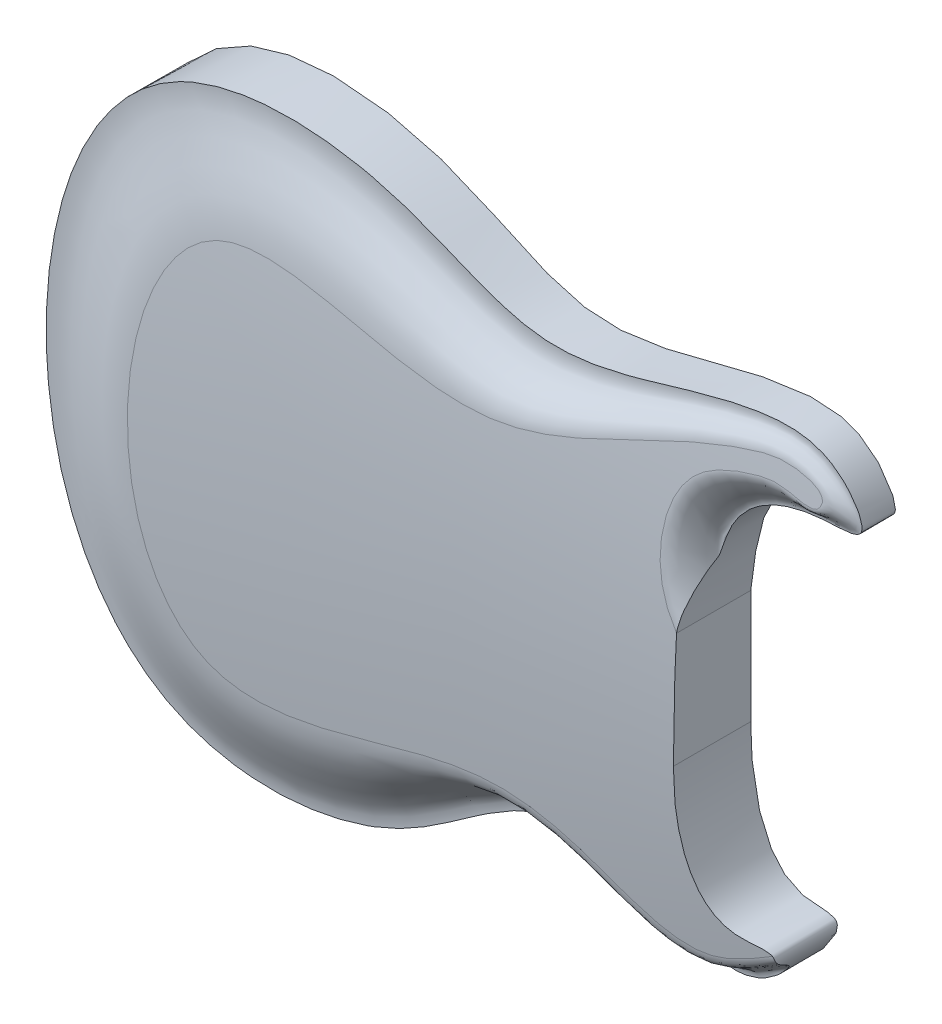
SolidWorks part; units mm, degrees
ref_plane "Front Plane" through (0, 0, 0) normal (0, 0, 1) x (1, 0, 0)
ref_plane "Top Plane" through (0, 0, 0) normal (0, 1, 0) x (1, 0, 0)
ref_plane "Right Plane" through (0, 0, 0) normal (1, 0, 0) x (0, 0, -1)
sketch "Sketch1" plane through (0, 0, 0) normal (0, 1, 0) x (1, 0, 0)
  line L0 (-380.9748, -51.9303) -> (97.4564, -30.6197) construction
  line L2 (-195.3346, 0) -> (195.3346, 0) construction
  line L3 (-592.5941, 1082.777) -> (269.486, 1121.1762) construction
  arc A0 (-380.9748, -51.9303) -> (97.4564, -30.6197) centre (-241.9267, 2207.5326) ccw
  point P2 (72.0815, -31.75)
  point P5 (-355.6, -50.8)
  dimension "D1" = 25.4
  dimension "D2" = 25.4
  dimension "D3" = 30.6197
  dimension "D4" = 97.4564
  dimension "D5" = 2.55
  dimension "D6" = 478.4312
  dimension "D7" = 12.7
  dimension "D8" = 1143
surface "Surface-Revolve1" sketch "Sketch1" parameters "D1"=30
ref_plane "Angled Plane" through (1.5542, 0, 34.8915) normal (0.0445, 0, 0.999) x (0.999, 0, -0.0445)
ref_plane "Plane1" through (0.989, 0, 22.204) normal (0.0445, 0, 0.999) x (0.999, 0, -0.0445)
sketch "Sketch2" plane through (-96.4883, 26.5703, 0) normal (0, 0, 1) x (1, 0, 0)
  line L1 (95.7101, 5.1797) -> (-196.7425, 5.1797) construction
  line L2 (-153.235, 105.762) -> (-153.235, -95.4025) construction
  line L3 (-65.0331, -89.9675) -> (-65.0331, 100.327) construction
  line L4 (-196.7425, 5.1797) -> (-260.2425, 5.1797) construction
  spline S0 degree 3 poles (207.7093, -26.5703) (148.9299, -5.4191) (71.935, 22.2868) (91.5633, 113.7917) (123.9586, 123.4584) (142.7496, 125.8642) (158.7707, 116.9684) (163.7795, 128.6124) (145.0344, 136.8672) (122.7071, 134.0197) (72.0163, 118.2186) (10.7256, 85.4574) (-70.8597, 100.4467) (-171.2577, 127.8192) (-210.7031, 4.9736) (-171.2932, -116.7149) (-66.5757, -90.9043) (-1.1762, -72.3825) (57.9574, -91.1798) (97.6769, -120.898) (155.3598, -95.4036) (183.8897, -70.5749) (207.7093, -49.8455) knots 0 0 0 0 0.128417 0.168213 0.191991 0.205462 0.220099 0.221295 0.235526 0.252941 0.284296 0.364515 0.419541 0.493426 0.585025 0.676623 0.750509 0.814713 0.847251 0.905045 0.920723 1 1 1 1
  dimension "D2" = 63.5
surface "Top Shape Trim"
sketch "Sketch3" plane through (0.989, 0, 22.204) normal (0.0445, 0, 0.999) x (0.999, 0, -0.0445)
  line L2 (29.1269, -97.8003) -> (104.2908, -52.1742) construction
  spline S1 degree 3 number of poles 252 (29.1269, -97.8003) -> (76.5867, 152.7438) construction
  spline S2 degree 3 number of poles 304 (110.6938, 8.1763) -> (104.2908, -52.1742)
  spline S3 degree 3 poles (76.5867, 152.7438) (77.0116, 152.023) (77.4158, 151.288) (78.1933, 149.7377) (78.5639, 148.9193) (79.2069, 147.255) (79.4824, 146.4068) (79.7761, 145.0925) (79.8529, 144.6501) (79.923, 143.9829) (79.9388, 143.7596) (79.9519, 143.3111) (79.9492, 143.0852) (79.9071, 142.4148) (79.8353, 141.9747) (79.5574, 141.1152) (79.3552, 140.7152) (78.8011, 139.9986) (78.4665, 139.6994) (77.7203, 139.1896) (77.3227, 138.9873) (76.4981, 138.6462) (76.0681, 138.5075) (75.2059, 138.2775) (74.7724, 138.1854) (73.467, 137.9542) (72.5904, 137.8587) (70.8312, 137.7244) (69.9485, 137.6867) (67.2957, 137.6172) (65.5204, 137.6282) (61.9713, 137.6325) (60.198, 137.626) (54.9028, 137.4324) (51.4013, 137.1025) (44.4679, 135.955) (41.0357, 135.1388) (36.8018, 133.7239) (35.9578, 133.4209) (34.2761, 132.7717) (33.4415, 132.4266) (30.978, 131.3356) (29.3812, 130.5312) (26.2852, 128.7568) (24.7861, 127.7868) (22.6175, 126.196) (21.908, 125.6431) (20.5172, 124.4895) (19.839, 123.8913) (17.8754, 122.0484) (16.6527, 120.7495) (14.3794, 118.0118) (13.3299, 116.572) (11.8745, 114.3155) (11.4091, 113.5472) (10.5158, 111.9803) (10.0891, 111.1837) (8.8743, 108.7783) (8.1462, 107.1459) (6.6995, 103.5299) (6.0067, 101.5373) (5.3859, 99.5193) knots 0.896592 0.896592 0.896592 0.896592 0.898438 0.898438 0.900391 0.900391 0.902344 0.902344 0.90332 0.90332 0.903809 0.903809 0.904297 0.904297 0.905273 0.905273 0.90625 0.90625 0.907227 0.907227 0.908203 0.908203 0.90918 0.90918 0.910156 0.910156 0.912109 0.912109 0.914063 0.914063 0.917969 0.917969 0.921875 0.921875 0.929688 0.929688 0.9375 0.9375 0.939453 0.939453 0.941406 0.941406 0.945313 0.945313 0.949219 0.949219 0.951172 0.951172 0.953125 0.953125 0.957031 0.957031 0.960938 0.960938 0.962891 0.962891 0.964844 0.964844 0.96875 0.96875 0.973375 0.973375 0.973375 0.973375 construction
  spline S4 degree 3 poles (5.3859, 99.5193) (3.3161, 93.0347) (11.5035, 51.9374) (81.5334, 21.0414) (110.6938, 8.1763) knots 0 0 0 0 0.583601 1 1 1 1 construction
sketch "Sketch4" plane through (0.989, 0, 22.204) normal (0.0445, 0, 0.999) x (0.999, 0, -0.0445)
  line L5 (110.6938, 8.1763) -> (104.2908, -52.1742)
  spline S0 degree 3 number of poles 304 (110.6938, 8.1763) -> (104.2908, -52.1742) construction
  spline S1 degree 3 number of poles 304 (110.6938, 8.1763) -> (104.2908, -52.1742)
surface "Construction Surface for Loft" sketch "Sketch4"
surface "Shape Loft"
delete or keep bodies "Body-Delete1" type delete bodies bodies 139
surface "Surface-Extend1" parameters "D1"=1.778
surface "Top Surface Knit"
sketch "Guitar Body Outline" plane through (0, 0, 0) normal (0, 0, 1) x (1, 0, 0)
  line L0 (0, 63.5) -> (0, 0)
  line L1 (0, 31.75) -> (-355.6, 31.75) construction
  line L2 (-286.0579, 184.15) -> (-286.0579, -120.65) construction
  line L3 (-163.7965, -118.8493) -> (-163.7965, 182.3493) construction
  spline S0 degree 3 poles (0, 63.5) (2.4707, 84.1763) (7.034, 122.3646) (46.8232, 139.9004) (87.3467, 136.0004) (67.0488, 173.6245) (2.0345, 177.7665) (-80.1818, 134.4451) (-173.9531, 195.6953) (-316.8898, 206.98) (-377.6823, 30.9941) (-317.9087, -140.8648) (-165.327, -137.5991) (-100.749, -67.3623) (-28.9342, -80.403) (20.3895, -123.3517) (55.7195, -68.503) (16.231, -73.6373) (1.1604, -36.0474) (0, -10.747) (0, 0) knots 0 0 0 0 0.044035 0.081332 0.096422 0.112661 0.147802 0.24108 0.300473 0.394246 0.522717 0.651187 0.744961 0.816316 0.847087 0.908535 0.926631 0.938591 0.975274 1 1 1 1
  dimension "D1" = 228.6
  dimension "D2" = 355.6
  dimension "D3" = 304.8
  dimension "D4" = 63.5
  dimension "D5" = 69.5421
extrude "Boss-Extrude1" add sketch "Guitar Body Outline" along normal blind 50.8 contours S0 L0
other "DeleteFace1"
surface "Surface-Trim1"
